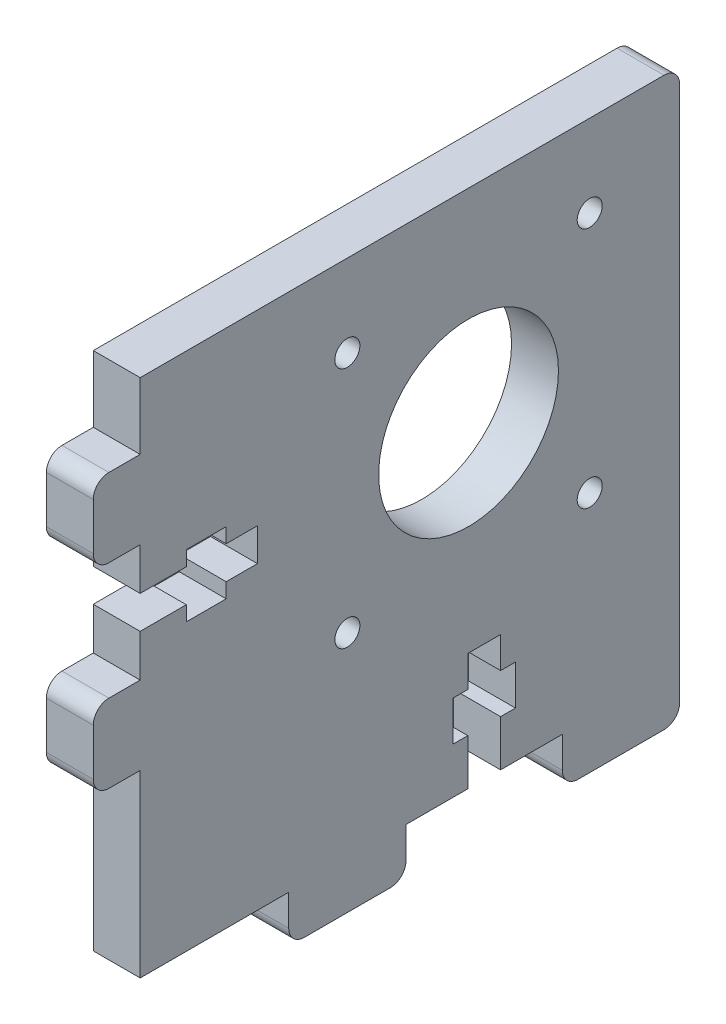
SolidWorks part; units mm, degrees
ref_plane "Спереди" through (0, 0, 0) normal (0, 0, 1) x (1, 0, 0)
ref_plane "Сверху" through (0, 0, 0) normal (0, 1, 0) x (1, 0, 0)
ref_plane "Справа" through (0, 0, 0) normal (1, 0, 0) x (0, 0, -1)
sketch "Эскиз1" plane through (0, 0, 0) normal (1, 0, 0) x (0, 0, -1)
  line L1 (0, 0) -> (69, 0)
  line L2 (0, 0) -> (0, 45)
  line L3 (0, 45) -> (69, 45)
  line L4 (69, 0) -> (69, 45)
  line L5 (20, 44.5) -> (64, 44.5) construction
  line L6 (20, 44.5) -> (20, 0.5) construction
  line L7 (20, 0.5) -> (64, 0.5) construction
  line L8 (64, 44.5) -> (64, 0.5) construction
  line L9 (26.5, 38) -> (57.5, 38) construction
  line L10 (26.5, 38) -> (26.5, 7) construction
  line L11 (26.5, 7) -> (57.5, 7) construction
  line L12 (57.5, 38) -> (57.5, 7) construction
  line L13 (0, 40) -> (-4, 40)
  line L14 (0, 40) -> (0, 30)
  line L15 (0, 30) -> (-4, 30)
  line L16 (-6, 38) -> (-6, 32)
  line L17 (0, 15) -> (-4, 15)
  line L18 (0, 15) -> (0, 5)
  line L19 (0, 5) -> (-4, 5)
  line L20 (-6, 13) -> (-6, 7)
  line L21 (0, 24.6) -> (15, 24.6)
  line L22 (0, 24.6) -> (0, 20.4)
  line L23 (0, 20.4) -> (15, 20.4)
  line L24 (15, 24.6) -> (15, 20.4)
  line L25 (5.9, 26.5) -> (11, 26.5)
  line L26 (5.9, 26.5) -> (5.9, 18.5)
  line L27 (5.9, 18.5) -> (11, 18.5)
  line L28 (11, 26.5) -> (11, 18.5)
  circle A0 centre (26.5, 38) radius 1.6
  circle A1 centre (57.5, 38) radius 1.6
  circle A2 centre (26.5, 7) radius 1.6
  circle A3 centre (57.5, 7) radius 1.6
  circle A4 centre (42, 22.5) radius 11.5
  arc A5 (-4, 5) -> (-6, 7) centre (-4, 7) cw
  arc A6 (-4, 15) -> (-6, 13) centre (-4, 13) ccw
  arc A7 (-4, 30) -> (-6, 32) centre (-4, 32) cw
  arc A8 (-4, 40) -> (-6, 38) centre (-4, 38) ccw
  point P13 (42, 7)
  point P14 (42, 44.5)
  point P15 (26.5, 22.5)
  point P16 (20, 22.5)
  point P37 (5.9, 22.5)
  point P38 (15, 22.5)
  point P43 (-6, 5)
  point P46 (-6, 15)
  point P49 (-6, 30)
  point P52 (-6, 40)
extrude "Бобышка-Вытянуть1" add sketch "Эскиз1" along normal blind 6 contours L17 A6 L20 A5 L19 L2 | L13 A8 L16 A7 L15 L2 | L25 L28 L21 L24 L23 L27 L26 L2 L1 L4 L3 A4 A3 A2 A1 A0
sketch "Эскиз2" plane through (6, 0, 0) normal (1, 0, 0) x (0, 0, -1)
  line L1 (69, 45) -> (0, 45)
  line L2 (69, 45) -> (69, 46.5)
  line L3 (67, 48.5) -> (0, 48.5)
  line L4 (0, 45) -> (0, 48.5)
  line L5 (69, 0) -> (0, 0)
  line L6 (69, 0) -> (69, -18)
  line L7 (69, -18) -> (0, -18)
  line L8 (0, 0) -> (0, -18)
  arc A4 (69, 46.5) -> (67, 48.5) centre (67, 46.5) ccw
  point P43 (69, 48.5)
  dimension "D15" = 2
  dimension "D1" = 3.5
  dimension "D2" = 18
extrude "Бобышка-Вытянуть2" add sketch "Эскиз2" against normal up to surface (6 mm away)
sketch "Эскиз3" plane through (6, 0, 0) normal (1, 0, 0) x (0, 0, -1)
  line L0 (0, -18) -> (69, -18) construction
  line L1 (69, -18) -> (54, -18)
  line L2 (69, -18) -> (69, -22)
  line L3 (67, -24) -> (56, -24)
  line L4 (54, -18) -> (54, -22)
  line L5 (34, -18) -> (19, -18)
  line L6 (34, -18) -> (34, -22)
  line L7 (32, -24) -> (21, -24)
  line L8 (19, -18) -> (19, -22)
  arc A0 (21, -24) -> (19, -22) centre (21, -22) cw
  arc A1 (34, -22) -> (32, -24) centre (32, -22) cw
  arc A2 (56, -24) -> (54, -22) centre (56, -22) cw
  arc A3 (69, -22) -> (67, -24) centre (67, -22) cw
  point P13 (19, -24)
  point P16 (34, -24)
  point P19 (54, -24)
  point P22 (69, -24)
  dimension "D6" = 2
  dimension "D1" = 15
  dimension "D2" = 15
  dimension "D3" = 20
  dimension "D4" = 6
  dimension "D5" = 6
extrude "Бобышка-Вытянуть3" add sketch "Эскиз3" against normal up to surface (6 mm away)
sketch "Эскиз4" plane through (6, 0, 0) normal (1, 0, 0) x (0, 0, -1)
  line L0 (34, -18) -> (54, -18) construction
  line L1 (41.9, -18) -> (46.1, -18)
  line L2 (41.9, -18) -> (41.9, -3)
  line L3 (41.9, -3) -> (46.1, -3)
  line L4 (46.1, -18) -> (46.1, -3)
  line L6 (40, -7) -> (48, -7)
  line L7 (40, -7) -> (40, -12.1)
  line L8 (40, -12.1) -> (48, -12.1)
  line L9 (48, -7) -> (48, -12.1)
  point P10 (44, -3)
  point P11 (44, -7)
  point P13 (34, -18)
  point P14 (54, -18)
extrude "Вырез-Вытянуть1" cut sketch "Эскиз4" against normal through all contours L7 L8 L2 L6 | L2 L6 L4 L3 | L9 L6 L4 L8 | L2 L8 L4 L6 | L8 L2 L4 M17
equation "\"D12@Эскиз1\"=\"D6@Эскиз1\"/2"
equation "\"D7@Эскиз4\"=\"D6@Эскиз4\"/2"
